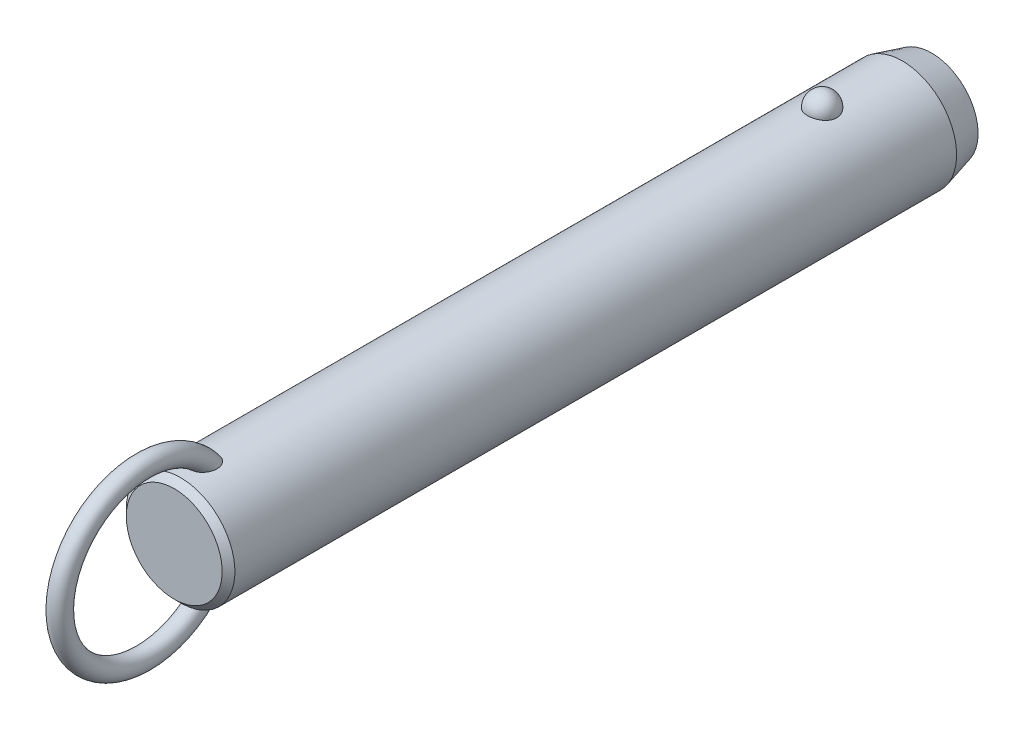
SolidWorks part; units mm, degrees
ref_plane "Front Plane" through (0, 0, 0) normal (0, 0, 1) x (1, 0, 0)
ref_plane "Top Plane" through (0, 0, 0) normal (0, 1, 0) x (1, 0, 0)
ref_plane "Right Plane" through (0, 0, 0) normal (1, 0, 0) x (0, 0, -1)
sketch "Sketch2" plane through (0, 0, 0) normal (0, 0, 1) x (1, 0, 0)
  circle A0 centre (0, 0) radius 11.1
  point P3 (0, 11.1)
  dimension "D1" = 22.2
extrude "Boss-Extrude1" add sketch "Sketch2" along normal blind 116.8
sketch "Sketch3" plane through (0, 0, 0) normal (0, 0, -1) x (-1, 0, 0)
  circle A0 centre (0, 0) radius 11.1
  dimension "D1" = 22.2
extrude "Boss-Extrude2" add sketch "Sketch3" along normal blind 25.4
chamfer "Chamfer1" distance 6 angle 15 1 edges at (-11.1, 0, -25.4)
sketch "Sketch12" plane through (0, 0, 0) normal (1, 0, 0) x (0, 0, -1)
  line L0 (-116.8, 11.1) -> (-116.8, -11.1) construction
  point P0 (-116.8, 0)
sketch "Sketch13" plane through (0, 0, 0) normal (1, 0, 0) x (0, 0, -1)
  circle A0 centre (-135.85, 0) radius 19.05
  point P2 (-116.8, 0)
  dimension "D1" = 38.1
sketch "Sketch14" plane through (0, 0, 0) normal (0, 1, 0) x (1, 0, 0)
  circle A0 centre (0, -118.8) radius 2
  point P2 (0, -116.8)
  dimension "D1" = 4
sweep "Sweep1" add profiles "Sketch14" path "Sketch13"
sketch "Sketch15" plane through (0, 0, 116.8) normal (0, 0, 1) x (1, 0, 0)
  circle A0 centre (0, 0) radius 11.1
  dimension "D1" = 22.2
extrude "Boss-Extrude3" add sketch "Sketch15" along normal blind 12.7
chamfer "Chamfer2" distance 1.3 angle 45 1 edges at (11.1, 0, 129.5)
sketch "Sketch18" plane through (0, 0, 0) normal (1, 0, 0) x (0, 0, -1)
  line L0 (19.4, 11.1) -> (-120.368, 11.1) construction
  line L1 (3, 14.1) -> (3, 8.1)
  line L2 (-120.368, -11.1) -> (19.4, -11.1) construction
  arc A0 (3, 14.1) -> (3, 8.1) centre (3, 11.1) ccw
  point P4 (0, 11.1)
  dimension "D1" = 25.2
revolve "Revolve1" add sketch "Sketch18" angle 360 about L1
